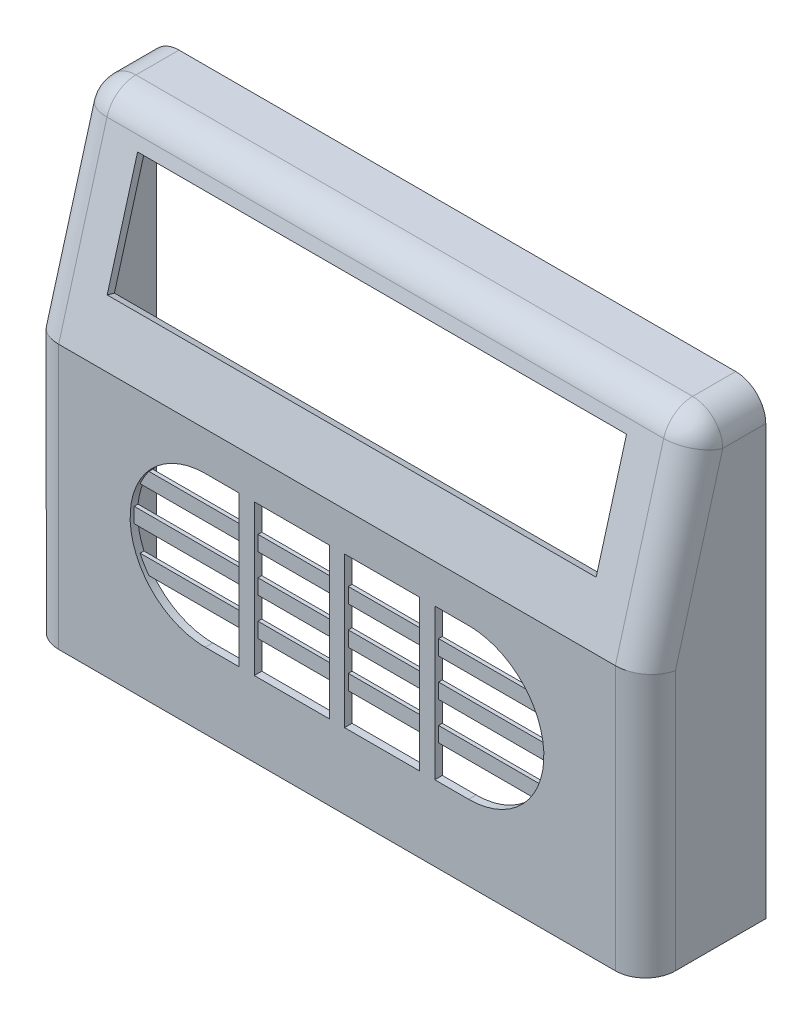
SolidWorks part; units mm, degrees
ref_plane "Front Plane" through (0, 0, 0) normal (0, 0, 1) x (1, 0, 0)
ref_plane "Top Plane" through (0, 0, 0) normal (0, 1, 0) x (1, 0, 0)
ref_plane "Right Plane" through (0, 0, 0) normal (1, 0, 0) x (0, 0, -1)
sketch "Sketch1" plane through (0, 0, 0) normal (1, 0, 0) x (0, 0, -1)
  line L0 (0, 0) -> (0, 60)
  line L1 (0, 60) -> (-8, 60)
  line L2 (-8, 60) -> (-15, 35)
  line L3 (-15, 35) -> (-15, 0)
  line L4 (-15, 0) -> (0, 0)
  dimension "D1" = 60
  dimension "D2" = 15
  dimension "D3" = 8
  dimension "D4" = 35
extrude "Boss-Extrude1" add sketch "Sketch1" along normal mid plane 80
fillet "Fillet1" radius 3 7 edges at (-40, 17.5, 15) (-40, 47.5, 11.5) (-40, 60, 4) (0, 60, 8) (40, 60, 4) (40, 47.5, 11.5) (40, 17.5, 15)
shell "Shell1" thickness 1
sketch "Sketch2" plane through (0, 0, 16) normal (0, 0, 1) x (1, 0, 0)
  line L0 (0, 30) -> (0, 10)
  line L1 (-17.5, 10) -> (17.5, 10)
  line L3 (-17.5, 30) -> (17.5, 30)
  line L5 (-27.5, 20) -> (27.5, 20)
  line L6 (-26.1603, 15) -> (26.1603, 15)
  line L7 (-26.1603, 25) -> (26.1603, 25)
  line L8 (-27.5, 25) -> (27.5, 25) construction
  line L9 (-27.5, 15) -> (27.5, 15) construction
  line L10 (-12, 30) -> (-12, 10)
  line L11 (12, 30) -> (12, 10)
  line L12 (37, 0) -> (-37, 0) construction
  arc A0 (-17.5, 30) -> (-17.5, 10) centre (-17.5, 20) ccw
  arc A3 (17.5, 10) -> (17.5, 30) centre (17.5, 20) ccw
  point P0 (0, 21.6464)
  dimension "D1" = 35
  dimension "D2" = 20
  dimension "D7" = 10
  dimension "D3" = 5
  dimension "D4" = 5
  dimension "D5" = 12
  dimension "D6" = 12
other "Vent1" parameters "RibsDepth"=1, "RibsWidth"=2, "RibsOffset"=0, "SparsDepth"=0.5, "SparsWidth"=2, "SparsOffset"=0.5, "D7"=1, "D8"=0, "Draft"=1
sketch "Sketch3" plane through (0, 6.7088, 23.96) normal (0, 0.2696, 0.963) x (1, 0, 0)
  line L1 (-32.5, 36.7408) -> (32.5, 36.7408)
  line L2 (-32.5, 36.7408) -> (-32.5, 51.7408)
  line L3 (-32.5, 51.7408) -> (32.5, 51.7408)
  line L4 (32.5, 36.7408) -> (32.5, 51.7408)
  line L5 (-32.5, 36.7408) -> (32.5, 51.7408) construction
  line L6 (-32.5, 51.7408) -> (32.5, 36.7408) construction
  line L7 (37, 58.7408) -> (-37, 58.7408) construction
  point P0 (0, 44.2408)
  point P5 (0, 0)
  dimension "D1" = 65
  dimension "D2" = 15
  dimension "D3" = 7
other "Vent2" parameters "D1"=1, "D2"=5, "D3"=0, "D4"=1, "D5"=2, "D6"=0, "D7"=1, "D8"=0, "D9"=1
